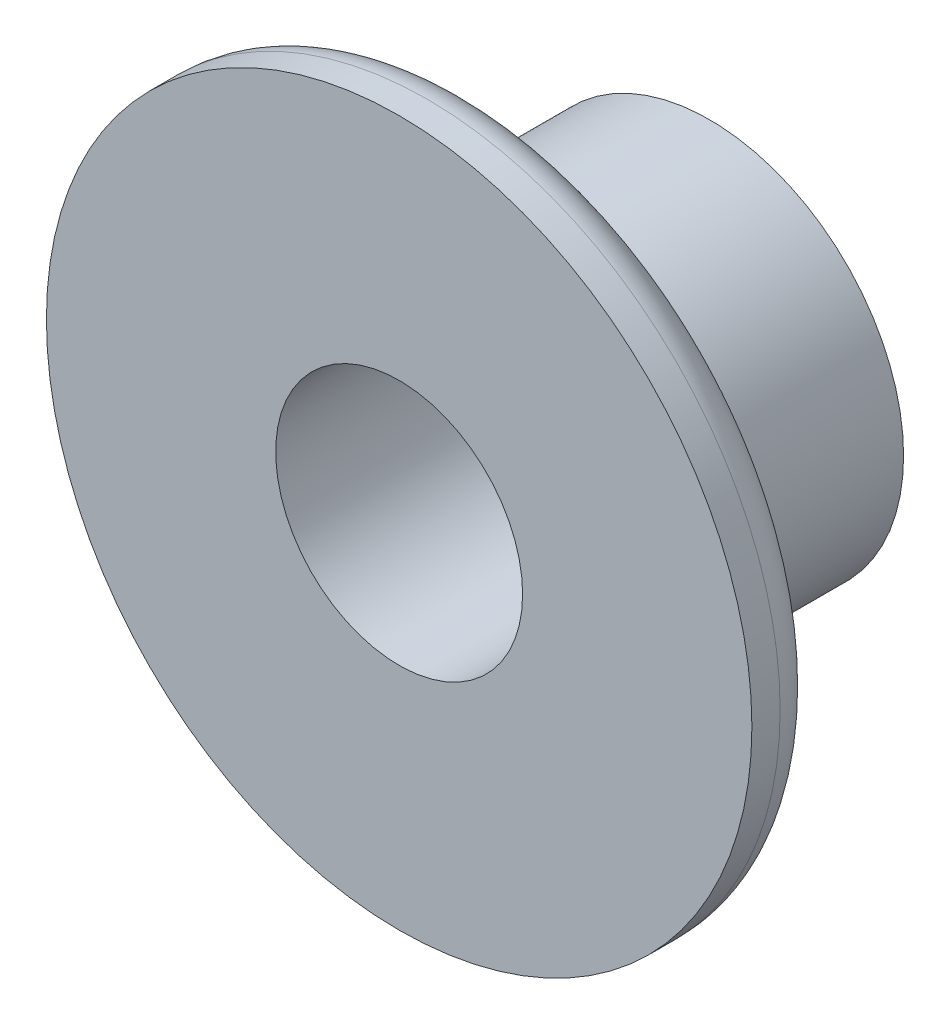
SolidWorks part; units mm, degrees
ref_plane "Front Plane" through (0, 0, 0) normal (0, 0, 1) x (1, 0, 0)
ref_plane "Top Plane" through (0, 0, 0) normal (0, 1, 0) x (1, 0, 0)
ref_plane "Right Plane" through (0, 0, 0) normal (1, 0, 0) x (0, 0, -1)
sketch "Sketch1" plane through (0, 0, 0) normal (0, 0, 1) x (1, 0, 0)
  circle A0 centre (0, 0) radius 2.2225
  circle A1 centre (0, 0) radius 3.4925
  dimension "D1" = 1.27
  dimension "D2" = 4.445
extrude "Boss-Extrude1" add sketch "Sketch1" along normal blind 5.588
sketch "Sketch2" plane through (0, 0, 5.588) normal (0, 0, 1) x (1, 0, 0)
  circle A0 centre (0, 0) radius 6.35
  circle A1 centre (0, 0) radius 2.2225
extrude "Boss-Extrude2" add sketch "Sketch2" against normal blind 1.27
fillet "Fillet1" radius 0.762 2 edges at (3.4925, 0, 4.318) (6.35, 0, 4.318)
